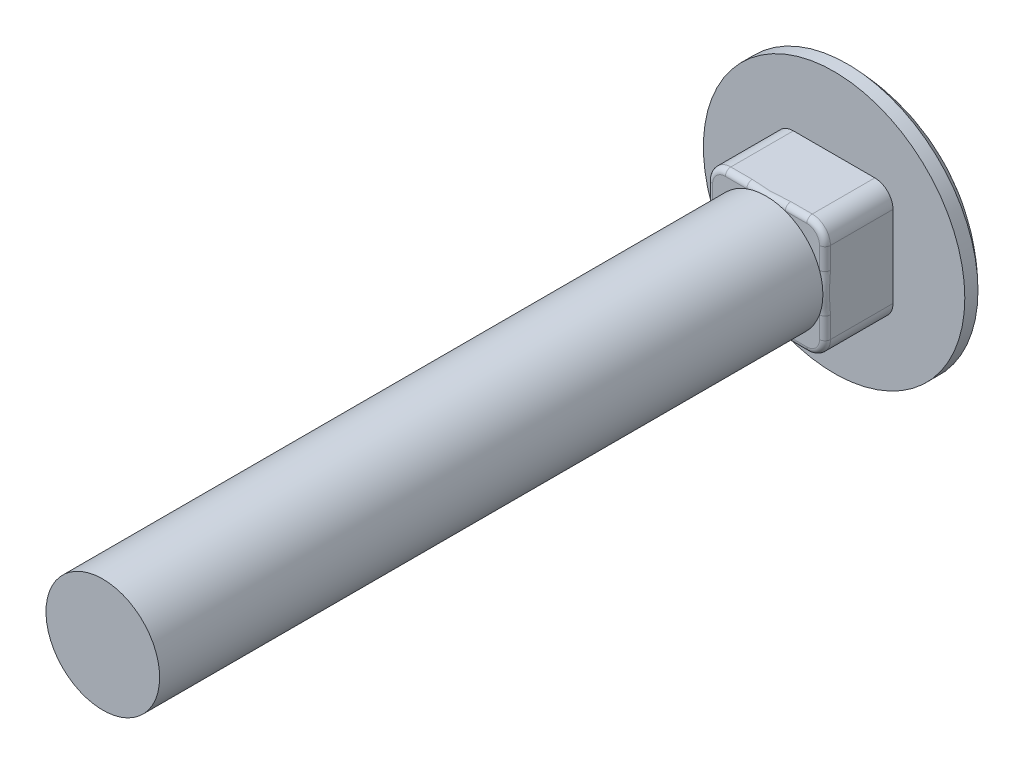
SolidWorks part; units mm, degrees
ref_plane "Front Plane" through (0, 0, 0) normal (0, 0, 1) x (1, 0, 0)
ref_plane "Top Plane" through (0, 0, 0) normal (0, 1, 0) x (1, 0, 0)
ref_plane "Right Plane" through (0, 0, 0) normal (1, 0, 0) x (0, 0, -1)
sketch "Sketch1" plane through (0, 0, 0) normal (1, 0, 0) x (0, 0, -1)
  line L0 (0, 0) -> (4.4704, 0)
  line L1 (0, 9.1313) -> (0.9207, 9.1313)
  line L2 (0, 0) -> (0, 9.1313)
  line L3 (0, 0) -> (15.0876, 0) construction
  arc A0 (0.9207, 9.1313) -> (4.4704, 0) centre (-8.2256, 0.3202) cw
  dimension "HeadRadius" = 12.7
  dimension "Head Height" = 4.4704
  dimension "Head dia/2" = 9.1313
  dimension "1/4ofHeight" = 0.9207
revolve "Revolve1" add sketch "Sketch1" angle 360 about L3
sketch "Sketch2" plane through (0, 0, 0) normal (0, 0, 1) x (1, 0, 0)
  line L0 (0, 0) -> (4.1148, 4.1148) construction
  line L1 (-4.1148, 4.1148) -> (4.1148, 4.1148)
  line L2 (-4.1148, 4.1148) -> (-4.1148, -4.1148)
  line L3 (-4.1148, -4.1148) -> (4.1148, -4.1148)
  line L4 (4.1148, 4.1148) -> (4.1148, -4.1148)
  dimension "D1" = 45
  dimension "Neck Width" = 8.2296
  dimension "NeckWidth/2" = 4.1148
extrude "Extrude1" add sketch "Sketch2" along normal blind 4.7498
sketch "Sketch3" plane through (0, 0, 4.7498) normal (0, 0, 1) x (1, 0, 0)
  circle A0 centre (0, 0) radius 3.9688
  dimension "Thread" = 7.9375
extrude "Extrude2" add sketch "Sketch3" along normal blind 46.3296
fillet "Fillet1" radius 1.27 4 edges at (-4.1148, 4.1148, 2.3749) (-4.1148, -4.1148, 2.3749) (4.1148, -4.1148, 2.3749) (4.1148, 4.1148, 2.3749)
fillet "Fillet2" radius 0.381 8 edges at (4.1148, 0, 4.7498) (3.7428, -3.7428, 4.7498) (0, -4.1148, 4.7498) (-3.7428, -3.7428, 4.7498) (-4.1148, 0, 4.7498) (-3.7428, 3.7428, 4.7498) (0, 4.1148, 4.7498) (3.7428, 3.7428, 4.7498)
